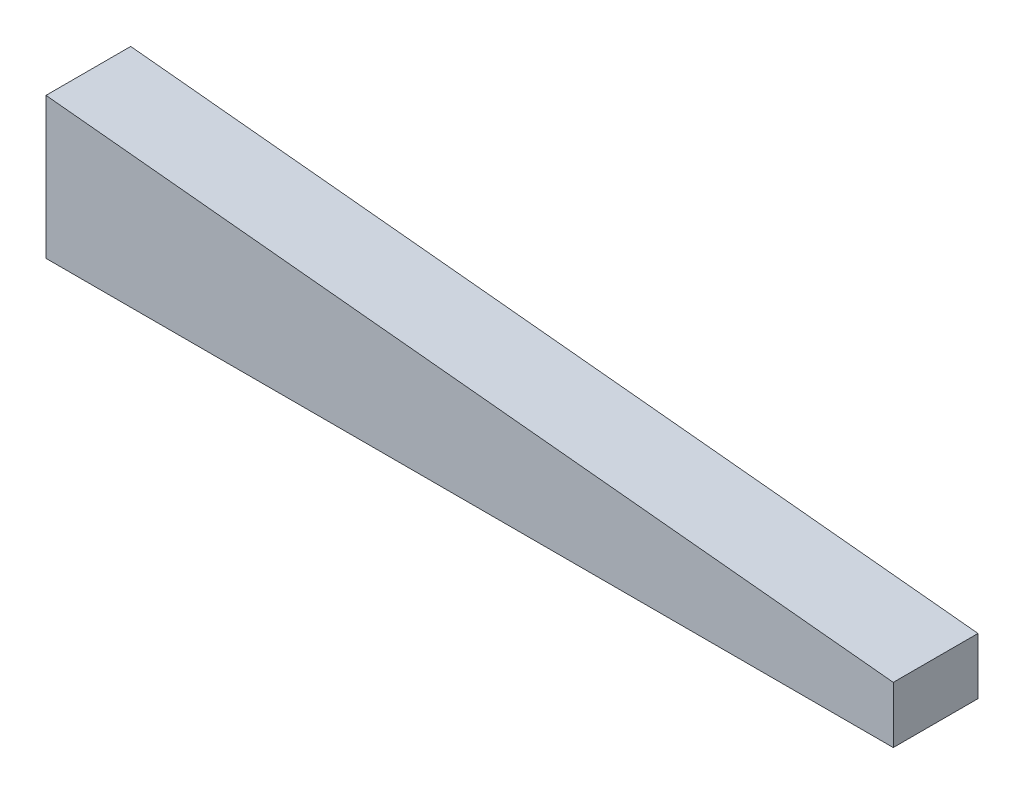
SolidWorks part; units mm, degrees
ref_plane "Plan de face" through (0, 0, 0) normal (0, 0, 1) x (1, 0, 0)
ref_plane "Plan de dessus" through (0, 0, 0) normal (0, 1, 0) x (1, 0, 0)
ref_plane "Plan de droite" through (0, 0, 0) normal (1, 0, 0) x (0, 0, -1)
sketch "Esquisse1" plane through (0, 0, 0) normal (0, 0, 1) x (1, 0, 0)
  line L0 (-15, 2.5) -> (15, -0.5)
  line L2 (-15, 2.5) -> (-15, -2.5)
  line L3 (-15, -2.5) -> (15, -2.5)
  line L4 (15, -0.5) -> (15, -2.5)
  line L5 (-15, 2.5) -> (15, -2.5) construction
  line L6 (-15, -2.5) -> (15, 2.5) construction
  point P0 (0, 0)
  point P6 (15, -0.5)
  dimension "D1" = 5
  dimension "D2" = 30
  dimension "D3" = 2
extrude "Boss.-Extru.1" add sketch "Esquisse1" along normal blind 3
